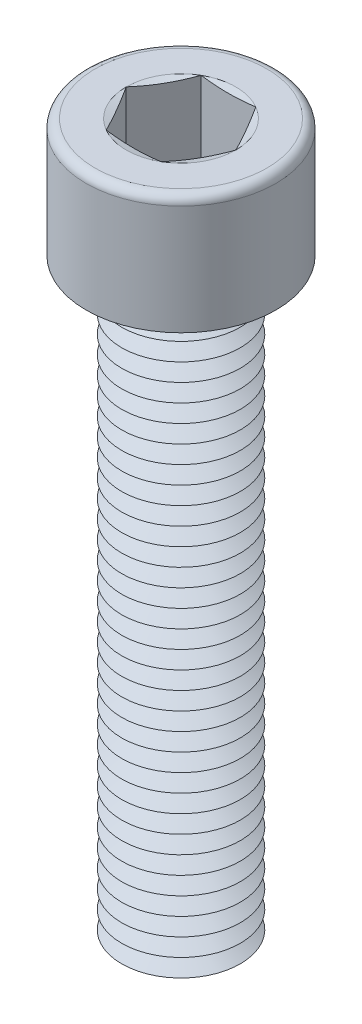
SolidWorks part; units mm, degrees
ref_plane "Front Plane" through (0, 0, 0) normal (0, 0, 1) x (1, 0, 0)
ref_plane "Top Plane" through (0, 0, 0) normal (0, 1, 0) x (1, 0, 0)
ref_plane "Right Plane" through (0, 0, 0) normal (1, 0, 0) x (0, 0, -1)
sketch "Sketch1" plane through (0, 0, 0) normal (0, 1, 0) x (1, 0, 0)
  circle A0 centre (0, 0) radius 5
  dimension "D1" = 10
extrude "Extrude1" add sketch "Sketch1" along normal blind 50
sketch "Sketch2" plane through (0, 50, 0) normal (0, 1, 0) x (1, 0, 0)
  circle A0 centre (0, 0) radius 8
  dimension "D1" = 16
extrude "Extrude2" add sketch "Sketch2" along normal blind 10
sketch "Sketch3" plane through (0, 60, 0) normal (0, 1, 0) x (1, 0, 0)
  line L1 (2.3094, 4) -> (-2.3094, 4)
  line L2 (-2.3094, 4) -> (-4.6188, 0)
  line L3 (-4.6188, 0) -> (-2.3094, -4)
  line L4 (-2.3094, -4) -> (2.3094, -4)
  line L5 (2.3094, -4) -> (4.6188, 0)
  line L6 (4.6188, 0) -> (2.3094, 4)
  circle A0 centre (0, 0) radius 4 construction
  dimension "D1" = 8
extrude "Extrude3" cut sketch "Sketch3" against normal blind 8
fillet "Fillet1" radius 0.75 1 edges at (0, 60, 8)
sketch "Sketch4" plane through (0, 0, 0) normal (1, 0, 0) x (0, 0, -1)
  line L0 (-4, 52) -> (0, 52)
  line L1 (0, 52) -> (0, 49.6906)
  line L2 (0, 49.6906) -> (-4, 52)
  dimension "D1" = 30
revolve "Cut-Revolve1" cut sketch "Sketch4" angle 360 about L1
sketch "Sketch5" plane through (0, 0, 0) normal (0, 0, 1) x (1, 0, 0)
  line L0 (-5, 0.75) -> (-5, -0.75)
  line L1 (-5, 50) -> (-5, 0) construction
  line L2 (-5, -0.75) -> (-3.701, 0)
  line L3 (-5, 0) -> (5, 0) construction
  line L4 (-3.701, 0) -> (-5, 0.75)
  dimension "D1" = 1.5
revolve "Cut-Revolve2" cut sketch "Sketch5" angle 360 about axis through (0, 50, 0) along (0, -1, 0)
pattern_linear "LPattern1" count 33 spacing 1.5 along (0, 1, 0) of "Cut-Revolve2"
sketch "Sketch6" plane through (0, 60, 0) normal (0, 1, 0) x (1, 0, 0)
  circle A0 centre (0, 0) radius 4.6188
extrude "Extrude4" cut sketch "Sketch6" against normal through all draft 75
